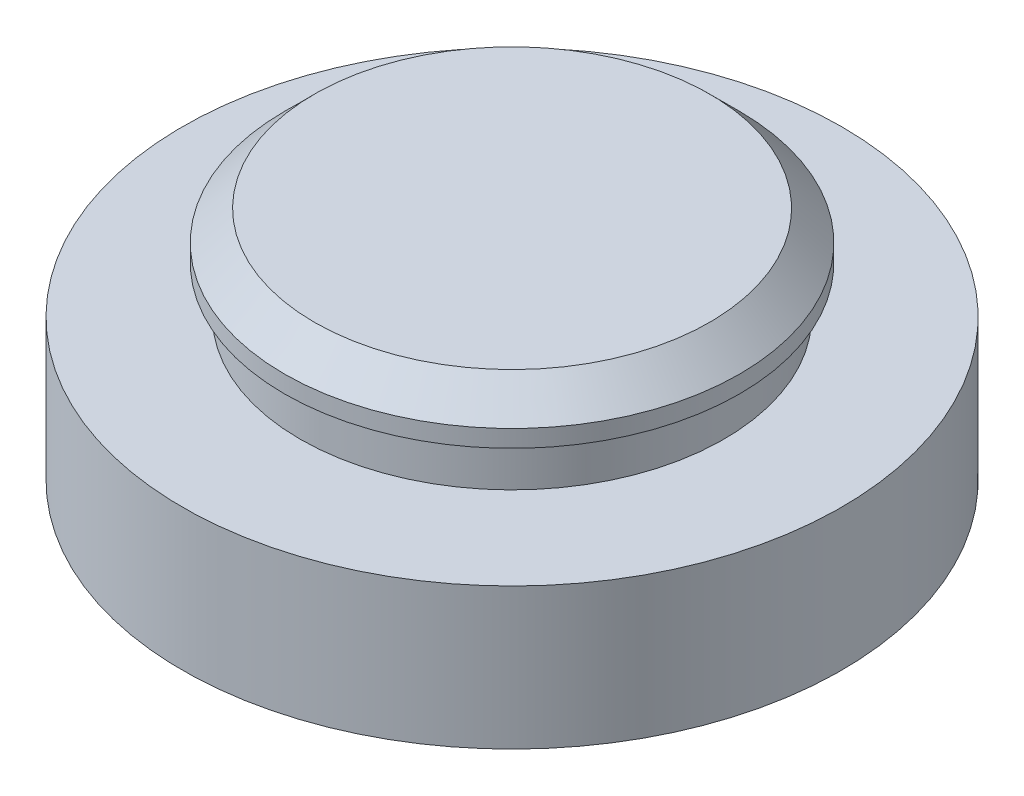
SolidWorks part; units mm, degrees
ref_plane "Front Plane" through (0, 0, 0) normal (0, 0, 1) x (1, 0, 0)
ref_plane "Top Plane" through (0, 0, 0) normal (0, 1, 0) x (1, 0, 0)
ref_plane "Right Plane" through (0, 0, 0) normal (1, 0, 0) x (0, 0, -1)
sketch "Sketch1" plane through (0, 0, 0) normal (0, 1, 0) x (1, 0, 0)
  circle A0 centre (0, 0) radius 13.5
extrude "Boss-Extrude1" add sketch "Sketch1" along normal blind 3
sketch "Sketch2" plane through (0, 3, 0) normal (0, 1, 0) x (1, 0, 0)
  circle A0 centre (0, 0) radius 14.5
extrude "Boss-Extrude2" add sketch "Sketch2" along normal blind 3
chamfer "Chamfer1" distance 1.905 angle 45 1 edges at (0, 6, 14.5)
sketch "Sketch3" plane through (0, 0, 0) normal (0, -1, 0) x (1, 0, 0)
  circle A0 centre (0, 0) radius 21
extrude "Boss-Extrude3" add sketch "Sketch3" along normal blind 9
sketch "Sketch4" plane through (0, -9, 0) normal (0, -1, 0) x (1, 0, 0)
  circle A0 centre (0, 0) radius 9
extrude "Boss-Extrude4" add sketch "Sketch4" along normal blind 7
fillet "Fillet1" radius 6.35 1 edges at (0, -16, -9)
